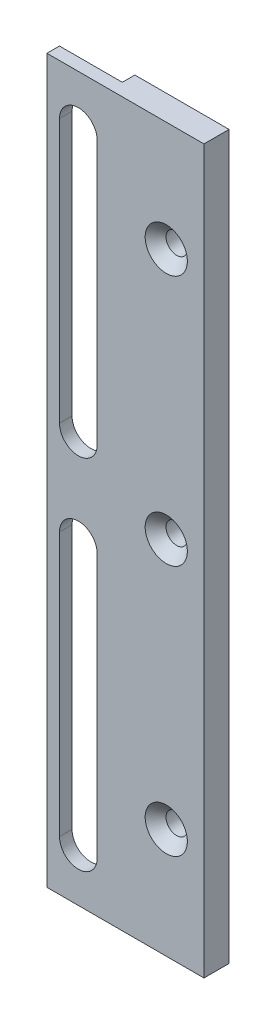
SolidWorks part; units mm, degrees
ref_plane "Front Plane" through (0, 0, 0) normal (0, 0, 1) x (1, 0, 0)
ref_plane "Top Plane" through (0, 0, 0) normal (0, 1, 0) x (1, 0, 0)
ref_plane "Right Plane" through (0, 0, 0) normal (1, 0, 0) x (0, 0, -1)
sketch "Sketch1" plane through (0, 0, 0) normal (1, 0, 0) x (0, 0, -1)
  line L1 (0, 0) -> (4, 0)
  line L2 (0, 0) -> (0, 115)
  line L3 (0, 115) -> (4, 115)
  line L4 (4, 0) -> (4, 115)
  dimension "D1" = 4
  dimension "D2" = 115
extrude "Boss-Extrude1" add sketch "Sketch1" along normal blind 25
sketch "Sketch6" plane through (0, 0, -4) normal (0, 0, -1) x (-1, 0, 0)
  line L0 (-5, 107) -> (-5, 65) construction
  line L1 (-2, 107) -> (-2, 65)
  line L2 (-8, 107) -> (-8, 65)
  line L3 (-5, 50) -> (-5, 8) construction
  line L4 (-2, 50) -> (-2, 8)
  line L5 (-8, 50) -> (-8, 8)
  line L6 (-25, 0) -> (0, 0) construction
  line L7 (-25, 115) -> (0, 115) construction
  line L8 (0, 0) -> (0, 115) construction
  arc A0 (-2, 107) -> (-8, 107) centre (-5, 107) ccw
  arc A1 (-8, 65) -> (-2, 65) centre (-5, 65) ccw
  arc A2 (-2, 50) -> (-8, 50) centre (-5, 50) ccw
  arc A3 (-8, 8) -> (-2, 8) centre (-5, 8) ccw
  point P2 (-5, 86)
  point P7 (-5, 29)
  dimension "D1" = 3
  dimension "D2" = 42
  dimension "D3" = 8
  dimension "D4" = 8
  dimension "D5" = 5
extrude "Cut-Extrude3" cut sketch "Sketch6" against normal through all
sketch "Sketch7" plane through (0, 0, -4) normal (0, 0, -1) x (-1, 0, 0)
  line L0 (-25, 0) -> (0, 0) construction
  line L1 (-10, 0) -> (0, 0)
  line L2 (-10, 0) -> (-10, 115)
  line L3 (-10, 115) -> (0, 115)
  line L4 (0, 0) -> (0, 115)
  dimension "D1" = 10
extrude "Cut-Extrude4" cut sketch "Sketch7" against normal blind 2
hole_wizard "CSK for M3 SFHCS1" positions "Sketch15" profile "Sketch14" countersink size "M3" standard "ANSI Metric"
sketch "Sketch15" plane through (0, 0, 0) normal (0, 0, 1) x (1, 0, 0)
  line L0 (19, 115) -> (19, 97.5) construction
  line L1 (25, 115) -> (0, 115) construction
  line L2 (19, 97.5) -> (19, 57.5) construction
  line L3 (19, 57.5) -> (19, 17.5) construction
  line L4 (19, 17.5) -> (19, 0) construction
  line L5 (25, 0) -> (0, 0) construction
  line L6 (25, 115) -> (25, 0) construction
  point P0 (19, 97.5)
  point P2 (19, 57.5)
  point P4 (19, 17.5)
  dimension "D1" = 40
  dimension "D2" = 6
sketch "Sketch14" plane through (19, 97.5, 0) normal (1, 0, 0) x (0, -1, 0)
  line L0 (0, 0) -> (0, 4)
  line L1 (0, 4) -> (1.7, 4)
  line L2 (1.7, 4) -> (1.7, 1.66)
  line L3 (1.7, 1.66) -> (3.36, 0)
  line L5 (3.36, 0) -> (0, 0)
  line L6 (-1.7, 1.66) -> (-3.36, 0) construction
  line L11 (0, -6.35) -> (0, 107.95) construction
  dimension "Thru Hole Dia." = 3.4
  dimension "Thru Hole Depth" = 4
  dimension "Near C'Sink Dia." = 6.72
  dimension "Near C'Sink Angle" = 90
